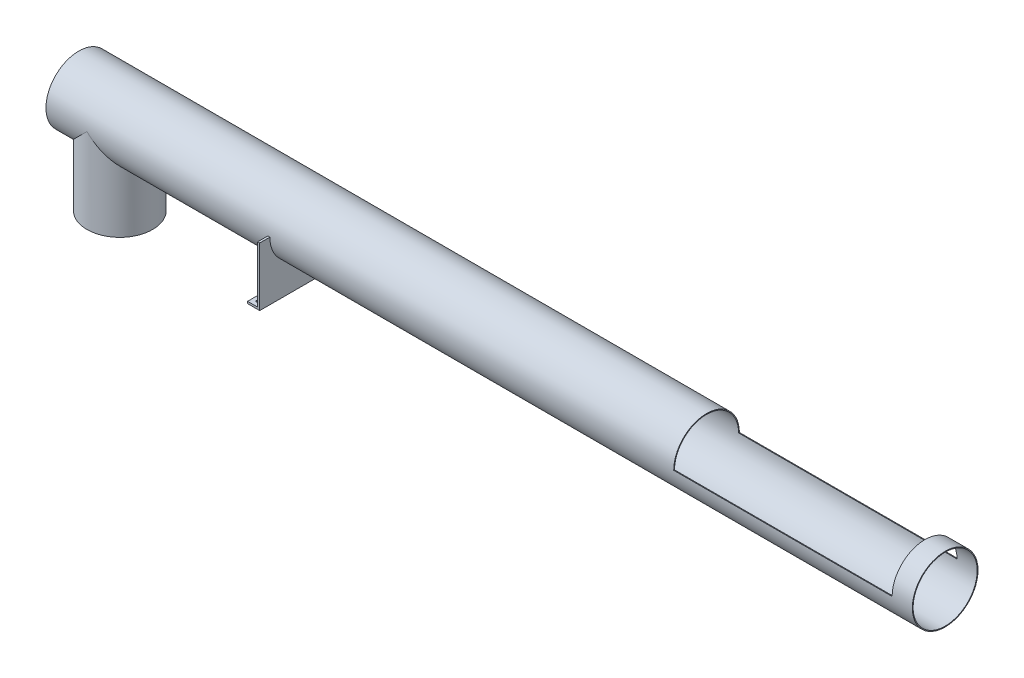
SolidWorks part; units mm, degrees
ref_plane "Front Plane" through (0, 0, 0) normal (0, 0, 1) x (1, 0, 0)
ref_plane "Top Plane" through (0, 0, 0) normal (0, 1, 0) x (1, 0, 0)
ref_plane "Right Plane" through (0, 0, 0) normal (1, 0, 0) x (0, 0, -1)
sketch "Sketch1" plane through (0, 0, 0) normal (1, 0, 0) x (0, 0, -1)
  circle A0 centre (0, 0) radius 162.5
  circle A1 centre (0, 0) radius 158.5
  dimension "D1" = 325
  dimension "D2" = 4
extrude "Boss-Extrude1" add sketch "Sketch1" along normal mid plane 4288
sketch "Sketch2" plane through (0, 0, 0) normal (0, 1, 0) x (1, 0, 0)
  line L0 (2144, 162.5) -> (-2144, 162.5) construction
  line L1 (2044, 162.5) -> (963, 162.5)
  line L2 (2044, 162.5) -> (2044, -162.5)
  line L3 (2044, -162.5) -> (963, -162.5)
  line L4 (963, 162.5) -> (963, -162.5)
  line L5 (-2144, -162.5) -> (2144, -162.5) construction
  line L6 (2144, -162.5) -> (2144, 162.5) construction
  dimension "D1" = 100
  dimension "D2" = 1081
extrude "Cut-Extrude1" cut sketch "Sketch2" along normal through all
ref_plane "Plane1" through (0, -420, 0) normal (0, 1, 0) x (1, 0, 0)
sketch "Sketch3" plane through (0, -420, 0) normal (0, 1, 0) x (1, 0, 0)
  line L0 (0, 0) -> (-2144, 0) construction
  line L1 (-2144, 162.5) -> (-2144, -162.5) construction
  circle A0 centre (-1941, 0) radius 162.5
  dimension "D1" = 325
  dimension "D2" = 203
extrude "Boss-Extrude2" add sketch "Sketch3" along normal up to next contours A0
sketch "Sketch5" plane through (0, -420, 0) normal (0, -1, 0) x (1, 0, 0)
  circle A0 centre (-1941, 0) radius 158.5
  circle A1 centre (-1941, 0) radius 162.5 construction
  dimension "D1" = 317
extrude "Cut-Extrude2" cut sketch "Sketch5" against normal up to surface (420 mm away)
ref_plane "Plane2" through (-1046, 0, 0) normal (-1, 0, 0) x (0, 0, 1)
sketch "Sketch8" plane through (-1046, 0, 0) normal (-1, 0, 0) x (0, 0, 1)
  line L0 (-162.5, 0) -> (162.5, 0) construction
  line L1 (-212.5, -280) -> (-212.5, 0)
  line L2 (212.5, -280) -> (-212.5, -280)
  line L4 (0, 0) -> (0, -280) construction
  line L5 (212.5, -280) -> (212.5, 0)
  line L6 (-162.5, 0) -> (-212.5, 0)
  line L8 (162.5, 0) -> (212.5, 0)
  arc A0 (-162.5, 0) -> (162.5, 0) centre (0, 0) ccw
  arc A1 (-162.5, 0) -> (162.5, 0) centre (0, 0) ccw construction
  circle A2 centre (0, 0) radius 162.5 construction
  point P11 (0, 0)
  point P14 (0, 0)
  point P17 (0, 0)
  point P18 (0, 0)
  point P19 (0, 0)
  dimension "D1" = 50
  dimension "D2" = 280
base flange "Base-Flange1" sketch "Sketch8" thickness 10 reverse thickness direction no parameters "D1"=0.7
sketch "Sketch39" plane through (0, -280, 0) normal (0, -1, 0) x (1, 0, 0)
  line L0 (-1036, -212.5) -> (-1036, 212.5) construction
  line L3 (-1036, 212.5) -> (-1046, 212.5) construction
  line L4 (-1036, 212.5) -> (-1096, 212.5)
  line L5 (-1036, 212.5) -> (-1036, -212.5)
  line L6 (-1036, -212.5) -> (-1096, -212.5)
  line L7 (-1096, 212.5) -> (-1096, -212.5)
  dimension "D1" = 60
base flange "Base-Flange2" sketch "Sketch39" thickness 10 reverse thickness direction yes parameters "D1"=0.7
ref_plane "Plane3" through (0, 0, 132.5) normal (0, 0, 1) x (1, 0, 0)
sketch "Sketch63" plane through (0, 0, 132.5) normal (0, 0, 1) x (1, 0, 0)
  line L0 (-1096, -280) -> (-1046, -280)
  line L1 (-1046, -280) -> (-1046, -200)
  line L2 (-1096, -280) -> (-1046, -200)
  point P2 (-1079.2398, -290.6424)
  point P4 (0, 0)
  dimension "D1" = 80
extrude "Boss-Extrude15" add sketch "Sketch63" along normal blind 10 contours L2 L1 L0
mirror "Mirror19" about plane through (0, 0, 0) normal (0, 0, 1) of "Boss-Extrude15"
sketch "Sketch66" plane through (0, -280, 0) normal (0, 1, 0) x (1, 0, 0)
  line L0 (-1071, -187.5) -> (-1096, -187.5) construction
  line L1 (-1096, -212.5) -> (-1096, -142.5) construction
  line L2 (-1046, -212.5) -> (-1096, -212.5) construction
  circle A0 centre (-1071, -187.5) radius 6.5
  dimension "D1" = 25
  dimension "D2" = 13
  dimension "D3" = 25
extrude "Cut-Extrude4" cut sketch "Sketch66" against normal blind 10 contours A0
mirror "Mirror20" about plane through (0, 0, 0) normal (0, 0, 1) of "Cut-Extrude4"
sketch "Bend-Lines1" [suppressed] plane through (0, 0, 0) normal (0, 1, 0) x (1, 0, 0)
sketch "Bounding-Box1" [suppressed] plane through (0, 0, 0) normal (0, 1, 0) x (1, 0, 0)
sheet metal parameters "Sheet-Metal12" thickness 10 parameters "D1"=0.7
flat pattern "Flat-Pattern12"
sketch "Bend-Lines2" plane through (0, 0, 0) normal (0, 1, 0) x (1, 0, 0)
sketch3d "Bounding-Box2" [suppressed]
  line L0 (-212.5, -280, 0) -> (212.5, -280, 0) construction
  line L1 (-212.5, 0, 0) -> (212.5, 0, 0) construction
  line L2 (-212.5, -280, 0) -> (-212.5, 0, 0) construction
  line L3 (212.5, -280, 0) -> (212.5, 0, 0) construction
sheet metal parameters "Sheet-Metal55" thickness 10 parameters "D1"=0.7
flat pattern "Flat-Pattern55"
sketch "Bend-Lines5" plane through (0, 0, 0) normal (0, 1, 0) x (1, 0, 0)
sketch3d "Bounding-Box5" [suppressed]
  line L0 (-1103.5, 212.5, 0) -> (-1103.5, -212.5, 0) construction
  line L1 (-1043.5, 212.5, 0) -> (-1043.5, -212.5, 0) construction
  line L2 (-1103.5, 212.5, 0) -> (-1043.5, 212.5, 0) construction
  line L3 (-1103.5, -212.5, 0) -> (-1043.5, -212.5, 0) construction
sheet metal parameters "Sheet-Metal59" thickness 10 parameters "D1"=0.7
flat pattern "Flat-Pattern59"
sketch "Bend-Lines6" plane through (0, 0, 0) normal (0, 1, 0) x (1, 0, 0)
sketch3d "Bounding-Box6" [suppressed]
  line L0 (-212.5, -280, 0) -> (212.5, -280, 0) construction
  line L1 (-212.5, 0, 0) -> (212.5, 0, 0) construction
  line L2 (-212.5, -280, 0) -> (-212.5, 0, 0) construction
  line L3 (212.5, -280, 0) -> (212.5, 0, 0) construction
sheet metal parameters "Sheet-Metal60" thickness 10 parameters "D1"=0.7
flat pattern "Flat-Pattern59"
sketch "Bend-Lines6" plane through (0, 0, 0) normal (0, 1, 0) x (1, 0, 0)
sketch3d "Bounding-Box6" [suppressed]
  line L0 (-212.5, -280, 0) -> (212.5, -280, 0) construction
  line L1 (-212.5, 0, 0) -> (212.5, 0, 0) construction
  line L2 (-212.5, -280, 0) -> (-212.5, 0, 0) construction
  line L3 (212.5, -280, 0) -> (212.5, 0, 0) construction
sheet metal parameters "Sheet-Metal61" thickness 10 parameters "D1"=0.7
flat pattern "Flat-Pattern59"
sketch "Bend-Lines6" plane through (0, 0, 0) normal (0, 1, 0) x (1, 0, 0)
sketch3d "Bounding-Box6" [suppressed]
  line L0 (-212.5, -280, 0) -> (212.5, -280, 0) construction
  line L1 (-212.5, 0, 0) -> (212.5, 0, 0) construction
  line L2 (-212.5, -280, 0) -> (-212.5, 0, 0) construction
  line L3 (212.5, -280, 0) -> (212.5, 0, 0) construction
sheet metal parameters "Sheet-Metal62" thickness 10 parameters "D1"=0.7
flat pattern "Flat-Pattern59"
sketch "Bend-Lines6" plane through (0, 0, 0) normal (0, 1, 0) x (1, 0, 0)
sketch3d "Bounding-Box6" [suppressed]
  line L0 (-212.5, -280, 0) -> (212.5, -280, 0) construction
  line L1 (-212.5, 0, 0) -> (212.5, 0, 0) construction
  line L2 (-212.5, -280, 0) -> (-212.5, 0, 0) construction
  line L3 (212.5, -280, 0) -> (212.5, 0, 0) construction
